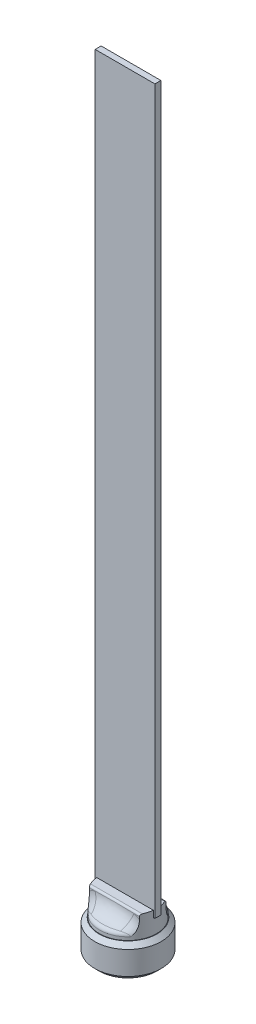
SolidWorks part; units mm, degrees
ref_plane "Front Plane" through (0, 0, 0) normal (0, 0, 1) x (1, 0, 0)
ref_plane "Top Plane" through (0, 0, 0) normal (0, 1, 0) x (1, 0, 0)
ref_plane "Right Plane" through (0, 0, 0) normal (1, 0, 0) x (0, 0, -1)
imported_body "Imported1"
sketch "Sketch1" plane through (0, 18.796, 0) normal (0, 1, 0) x (1, 0, 0)
  line L0 (-11.7773, 1.1811) -> (11.7773, 1.1811)
  line L1 (11.19, 1.1811) -> (-11.19, 1.1811) construction
  line L2 (-11.19, -1.1811) -> (11.19, -1.1811) construction
  line L3 (11.7773, -1.1811) -> (-11.7773, -1.1811)
  arc A0 (-11.7773, 1.1811) -> (-11.7773, -1.1811) centre (0, 0) ccw
  arc A1 (11.7773, -1.1811) -> (11.7773, 1.1811) centre (0, 0) ccw
  dimension "D1" = 23.6728
extrude "Boss-Extrude1" add sketch "Sketch1" along normal offset from surface (286.004 mm away) 304.8
